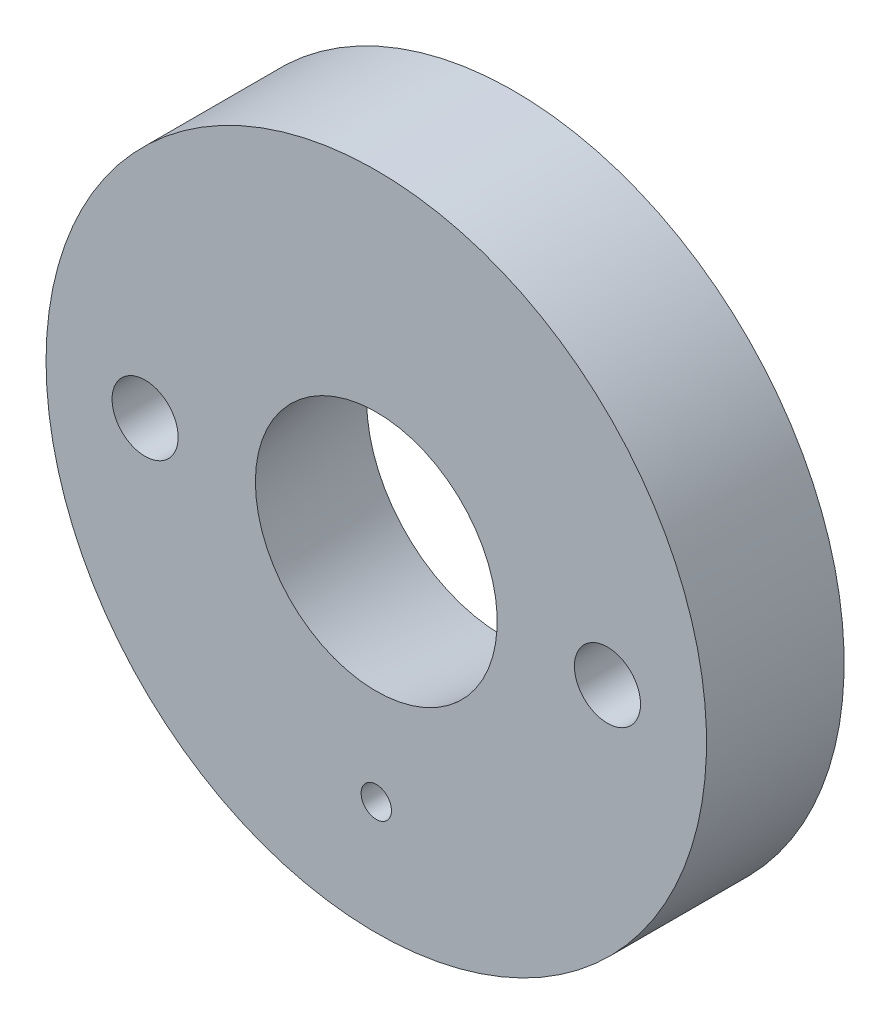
SolidWorks part; units mm, degrees
ref_plane "Front Plane" through (0, 0, 0) normal (0, 0, 1) x (1, 0, 0)
ref_plane "Top Plane" through (0, 0, 0) normal (0, 1, 0) x (1, 0, 0)
ref_plane "Right Plane" through (0, 0, 0) normal (1, 0, 0) x (0, 0, -1)
sketch "Sketch4" plane through (0, 0, 0) normal (0, 1, 0) x (1, 0, 0)
  line L0 (0, 11.3709) -> (0, -12.257) construction
  line L1 (-15.24, 0) -> (9.1558, 0) construction
  line L2 (-15.24, 6.35) -> (-15.24, 0)
  line L3 (-15.24, 0) -> (-5.58, 0)
  line L4 (-5.58, 0) -> (-6.35, 6.35)
  line L5 (-6.35, 6.35) -> (-15.24, 6.35)
  dimension "D1" = 6.35
  dimension "D2" = 6.35
  dimension "D3" = 15.24
  dimension "D4" = 5.58
revolve "Revolve1" add sketch "Sketch4" angle 360 about L0
sketch "Sketch5" plane through (0, 0, -6.35) normal (0, 0, -1) x (-1, 0, 0)
  circle A0 centre (10.668, 0) radius 1.525
  circle A1 centre (-10.668, 0) radius 1.525
  point P4 (0, 0)
  dimension "D1" = 3.05
  dimension "D2" = 3.05
  dimension "D3" = 10.668
  dimension "D4" = 10.668
extrude "Cut-Extrude1" cut sketch "Sketch5" against normal blind 10
sketch "Sketch6" plane through (0, 0, -6.35) normal (0, 0, -1) x (-1, 0, 0)
  circle A0 centre (0, 0) radius 7.62
extrude "Cut-Extrude2" cut sketch "Sketch6" against normal blind 0.508
sketch "Sketch7" plane through (0, 0, 0) normal (0, 0, 1) x (1, 0, 0)
  circle A0 centre (0, -10) radius 0.7
  circle A1 centre (0, 0) radius 15.24 construction
  dimension "D1" = 1.4
  dimension "D2" = 10
extrude "Cut-Extrude3" cut sketch "Sketch7" against normal through all
